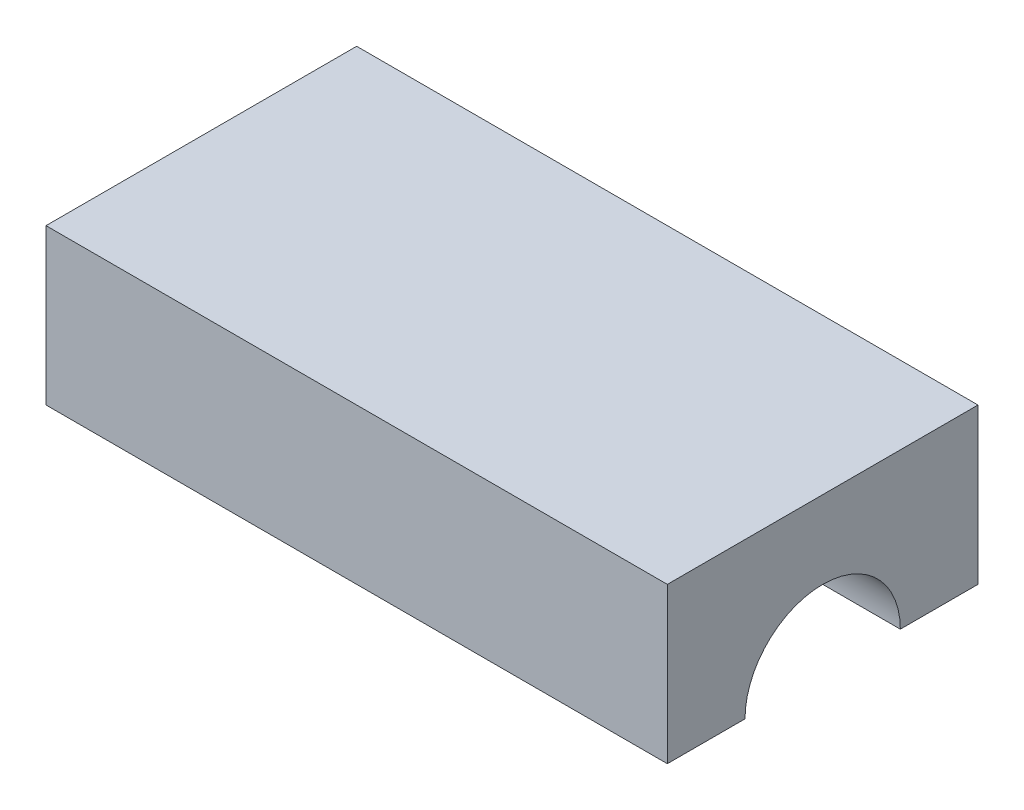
SolidWorks part; units mm, degrees
ref_plane "Front Plane" through (0, 0, 0) normal (0, 0, 1) x (1, 0, 0)
ref_plane "Top Plane" through (0, 0, 0) normal (0, 1, 0) x (1, 0, 0)
ref_plane "Right Plane" through (0, 0, 0) normal (1, 0, 0) x (0, 0, -1)
sketch "Sketch1" plane through (0, 0, 0) normal (0, 1, 0) x (1, 0, 0)
  line L0 (0, 0) -> (101.6, 0)
  line L1 (0, 0) -> (0, -50.8)
  line L2 (101.6, 0) -> (101.6, -50.8)
  line L3 (0, -50.8) -> (101.6, -50.8)
  dimension "D1" = 50.8
  dimension "D2" = 101.6
extrude "Boss-Extrude1" add sketch "Sketch1" along normal blind 25.4
sketch "Sketch2" plane through (0, 0, 0) normal (-1, 0, 0) x (0, 0, 1)
  line L0 (0, 0) -> (50.8, 0) construction
  circle A0 centre (25.4, 0) radius 12.7
  dimension "D1" = 25.4
extrude "Cut-Extrude1" cut sketch "Sketch2" against normal blind 3.81
sketch "Sketch3" plane through (101.6, 0, 0) normal (1, 0, 0) x (0, 0, -1)
  line L0 (-50.8, 0) -> (0, 0) construction
  circle A0 centre (-25.4, 0) radius 12.7
  dimension "D1" = 25.4
extrude "Cut-Extrude2" cut sketch "Sketch3" against normal blind 48.26
sketch "Sketch4" plane through (3.81, 0, 0) normal (-1, 0, 0) x (0, 0, 1)
  line L0 (12.7, 0) -> (38.1, 0) construction
  circle A0 centre (25.4, 0) radius 6.35
  dimension "D1" = 12.7
extrude "Cut-Extrude3" cut sketch "Sketch4" against normal blind 45.72
loft "Cut-Loft1" cut
